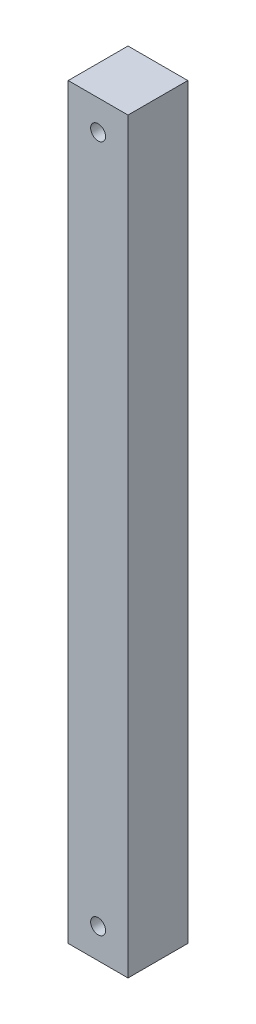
SolidWorks part; units mm, degrees
ref_plane "Front Plane" through (0, 0, 0) normal (0, 0, 1) x (1, 0, 0)
ref_plane "Top Plane" through (0, 0, 0) normal (0, 1, 0) x (1, 0, 0)
ref_plane "Right Plane" through (0, 0, 0) normal (1, 0, 0) x (0, 0, -1)
sketch "Sketch1" plane through (0, 0, 0) normal (0, 0, 1) x (1, 0, 0)
  line L1 (10, 0) -> (8, 0)
  line L2 (10, 0) -> (10, 25)
  line L3 (10, 25) -> (8, 25)
  line L4 (8, 0) -> (8, 25)
  circle A2 centre (9, 24) radius 0.25
  circle A3 centre (9, 1) radius 0.25
extrude "Boss-Extrude1" add sketch "Sketch1" along normal blind 2
equation "\"D1@Boss-Extrude1\"=2"
